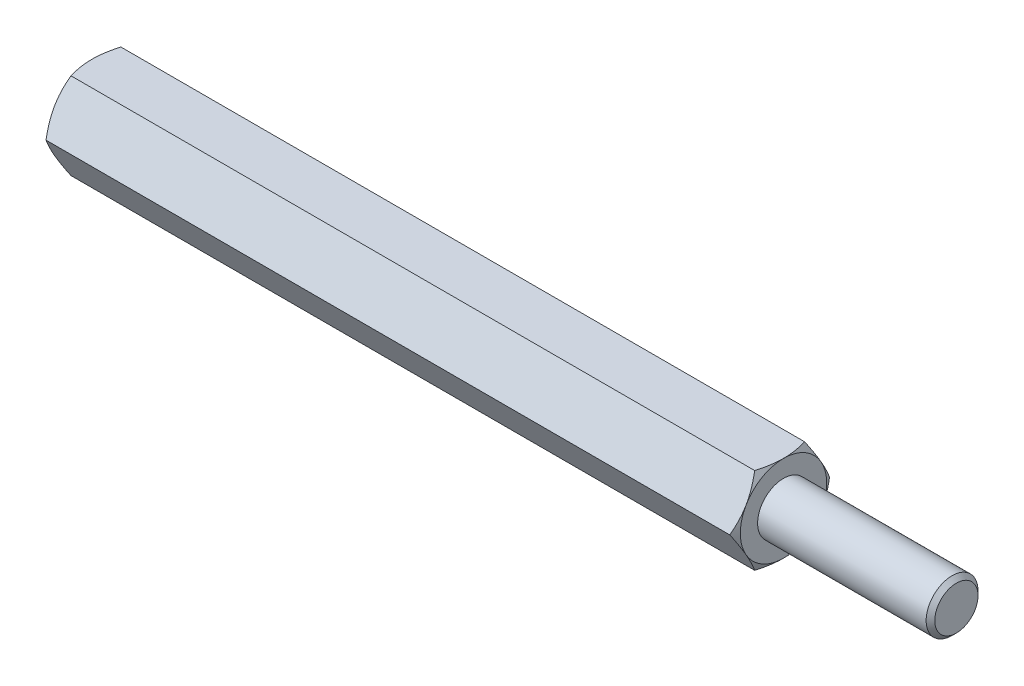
SolidWorks part; units mm, degrees
ref_plane "Front Plane" through (0, 0, 0) normal (0, 0, 1) x (1, 0, 0)
ref_plane "Top Plane" through (0, 0, 0) normal (0, 1, 0) x (1, 0, 0)
ref_plane "Right Plane" through (0, 0, 0) normal (1, 0, 0) x (0, 0, -1)
sketch "Sketch1" plane through (0, 0, 0) normal (1, 0, 0) x (0, 0, -1)
  line L1 (1.4434, 2.5) -> (-1.4434, 2.5)
  line L2 (-1.4434, 2.5) -> (-2.8868, 0)
  line L3 (-2.8868, 0) -> (-1.4434, -2.5)
  line L4 (-1.4434, -2.5) -> (1.4434, -2.5)
  line L5 (1.4434, -2.5) -> (2.8868, 0)
  line L6 (2.8868, 0) -> (1.4434, 2.5)
  circle A0 centre (0, 0) radius 2.5 construction
  dimension "D1" = 5
extrude "Extrude2" add sketch "Sketch1" along normal mid plane 40
sketch "Sketch2" plane through (0, 0, 0) normal (0, 0, 1) x (1, 0, 0)
  line L0 (-20, 2.5) -> (-18.5, 5.0981)
  line L1 (-20, 5.5) -> (-20, 2.5)
  line L3 (0, 0) -> (50000, 0) construction
  arc A0 (-18.5, 5.0981) -> (-20, 5.5) centre (-19.1962, 5.5) ccw
  dimension "D1" = 30
  dimension "D2" = 3
revolve "Cut-Revolve1" cut sketch "Sketch2" angle 360 about L3
mirror "Mirror1" about plane through (0, 0, 0) normal (1, 0, 0) of "Cut-Revolve1"
sketch "Sketch3" plane through (-20, 0, 0) normal (-1, 0, 0) x (0, 0, 1)
  circle A0 centre (0, 0) radius 1.25
  dimension "D1" = 2.5
extrude "Extrude3" cut sketch "Sketch3" against normal blind 10
sketch "Sketch4" plane through (0, 0, 0) normal (0, 0, 1) x (1, 0, 0)
  line L0 (-10, 0) -> (-10, 1.25)
  line L1 (19.7767, 0) -> (-19.7767, 0) construction
  line L2 (-10, 1.25) -> (-9.2783, 0)
  line L3 (-9.2783, 0) -> (-10, 0)
  line L4 (-20, 1.25) -> (-20, -1.25) construction
  point P4 (-20, 0)
  dimension "D1" = 30
  dimension "D2" = 1.25
  dimension "D3" = 10
revolve "Cut-Revolve2" cut sketch "Sketch4" angle 360 about L3
sketch "Sketch5" plane through (20, 0, 0) normal (1, 0, 0) x (0, 0, -1)
  circle A0 centre (0, 0) radius 1.5
  dimension "D1" = 3
extrude "Extrude4" add sketch "Sketch5" along normal blind 10
chamfer "Chamfer1" distance 0.25 angle 45 1 edges at (30, 0, -1.5)
equation "\"D2@Sketch4\" = \"D1@Sketch3\"/2"
